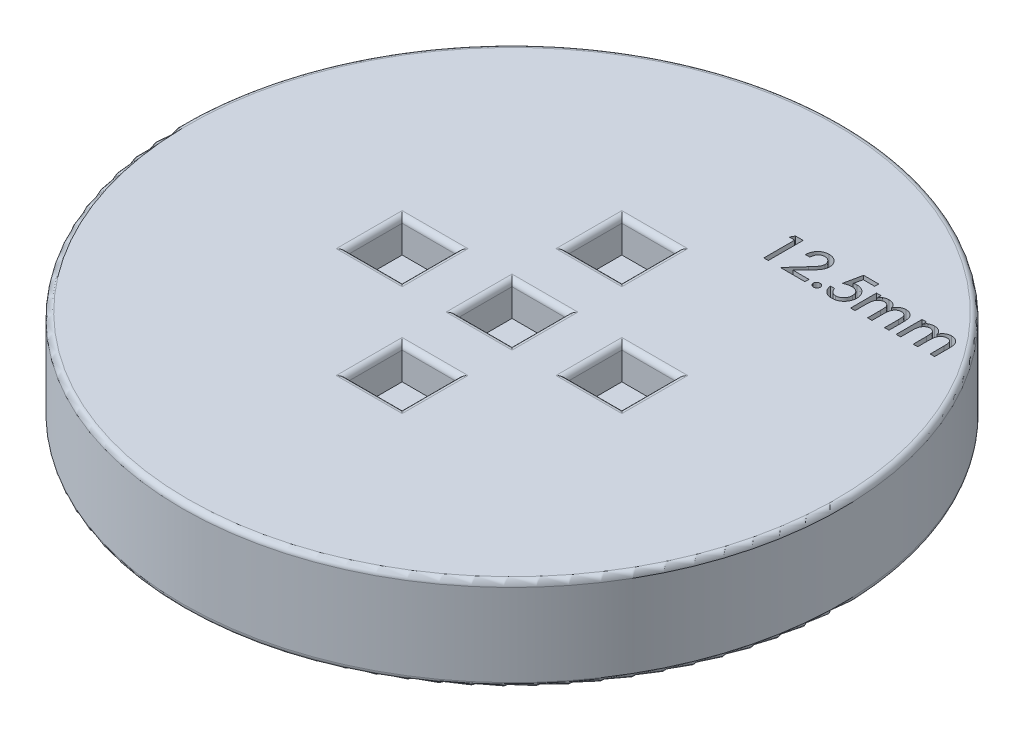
SolidWorks part; units mm, degrees
ref_plane "Front Plane" through (0, 0, 0) normal (0, 0, 1) x (1, 0, 0)
ref_plane "Top Plane" through (0, 0, 0) normal (0, 1, 0) x (1, 0, 0)
ref_plane "Right Plane" through (0, 0, 0) normal (1, 0, 0) x (0, 0, -1)
sketch "Sketch1" plane through (0, 0, 0) normal (0, 1, 0) x (1, 0, 0)
  circle A0 centre (0, 0) radius 30
extrude "Boss-Extrude1" add sketch "Sketch1" along normal blind 8.5
sketch "Sketch2" plane through (0, 8.5, 0) normal (0, 1, 0) x (1, 0, 0)
  line L0 (0, 0) -> (0, -10) construction
  line L1 (0, 0) -> (10, 0) construction
  line L2 (0, 0) -> (-10, 0) construction
  line L3 (0, 0) -> (0, 10) construction
  line L5 (-2.5, -7.5) -> (2.5, -7.5)
  line L6 (-2.5, -7.5) -> (-2.5, -12.5)
  line L7 (-2.5, -12.5) -> (2.5, -12.5)
  line L8 (2.5, -7.5) -> (2.5, -12.5)
  line L9 (-2.5, -7.5) -> (2.5, -12.5) construction
  line L10 (-2.5, -12.5) -> (2.5, -7.5) construction
  line L11 (-7.5, -2.5) -> (-12.5, -2.5)
  line L12 (-7.5, -2.5) -> (-7.5, 2.5)
  line L13 (-7.5, 2.5) -> (-12.5, 2.5)
  line L14 (-12.5, -2.5) -> (-12.5, 2.5)
  line L15 (-7.5, -2.5) -> (-12.5, 2.5) construction
  line L16 (-7.5, 2.5) -> (-12.5, -2.5) construction
  line L17 (2.5, -2.5) -> (-2.5, -2.5)
  line L18 (2.5, -2.5) -> (2.5, 2.5)
  line L19 (2.5, 2.5) -> (-2.5, 2.5)
  line L20 (-2.5, -2.5) -> (-2.5, 2.5)
  line L21 (2.5, -2.5) -> (-2.5, 2.5) construction
  line L22 (2.5, 2.5) -> (-2.5, -2.5) construction
  line L23 (-2.5, 12.5) -> (2.5, 12.5)
  line L24 (-2.5, 12.5) -> (-2.5, 7.5)
  line L25 (-2.5, 7.5) -> (2.5, 7.5)
  line L26 (2.5, 12.5) -> (2.5, 7.5)
  line L27 (-2.5, 12.5) -> (2.5, 7.5) construction
  line L28 (-2.5, 7.5) -> (2.5, 12.5) construction
  line L29 (12.5, -2.5) -> (7.5, -2.5)
  line L30 (12.5, -2.5) -> (12.5, 2.5)
  line L31 (12.5, 2.5) -> (7.5, 2.5)
  line L32 (7.5, -2.5) -> (7.5, 2.5)
  line L33 (12.5, -2.5) -> (7.5, 2.5) construction
  line L34 (12.5, 2.5) -> (7.5, -2.5) construction
  dimension "D1" = 5
  dimension "D2" = 10
  dimension "D3" = 5
  dimension "D4" = 5
  dimension "D5" = 5
  dimension "D6" = 5
  dimension "D7" = 5
  dimension "D8" = 5
extrude "Cut-Extrude1" cut sketch "Sketch2" against normal blind 3
fillet "Fillet1" radius 0.5 6 edges at (2.5, 8.5, 0) (0, 8.5, 2.5) (-12.5, 8.5, 0) (-10, 8.5, 2.5) (-7.5, 8.5, 0) (-10, 8.5, -2.5)
sketch "Sketch3" plane through (0, 8.5, 0) normal (0, 1, 0) x (1, 0, 0)
sketch "Sketch4" plane through (0, 0, 0) normal (0, -1, 0) x (-1, 0, 0)
  line L0 (0, 0) -> (-10, 0) construction
  line L1 (0, 0) -> (0, -10) construction
  line L2 (0, 0) -> (0, 10) construction
  line L3 (0, 0) -> (10, 0) construction
  line L5 (-2.5, 2.5) -> (2.5, 2.5)
  line L6 (-2.5, 2.5) -> (-2.5, -2.5)
  line L7 (-2.5, -2.5) -> (2.5, -2.5)
  line L8 (2.5, 2.5) -> (2.5, -2.5)
  line L9 (-2.5, 2.5) -> (2.5, -2.5) construction
  line L10 (-2.5, -2.5) -> (2.5, 2.5) construction
  line L11 (-2.5, -7.5) -> (2.5, -7.5)
  line L12 (-2.5, -7.5) -> (-2.5, -12.5)
  line L13 (-2.5, -12.5) -> (2.5, -12.5)
  line L14 (2.5, -7.5) -> (2.5, -12.5)
  line L15 (-2.5, -7.5) -> (2.5, -12.5) construction
  line L16 (-2.5, -12.5) -> (2.5, -7.5) construction
  line L17 (7.5, 2.5) -> (12.5, 2.5)
  line L18 (7.5, 2.5) -> (7.5, -2.5)
  line L19 (7.5, -2.5) -> (12.5, -2.5)
  line L20 (12.5, 2.5) -> (12.5, -2.5)
  line L21 (7.5, 2.5) -> (12.5, -2.5) construction
  line L22 (7.5, -2.5) -> (12.5, 2.5) construction
  line L23 (-12.5, 2.5) -> (-7.5, 2.5)
  line L24 (-12.5, 2.5) -> (-12.5, -2.5)
  line L25 (-12.5, -2.5) -> (-7.5, -2.5)
  line L26 (-7.5, 2.5) -> (-7.5, -2.5)
  line L27 (-12.5, 2.5) -> (-7.5, -2.5) construction
  line L28 (-12.5, -2.5) -> (-7.5, 2.5) construction
  line L29 (2.5, 7.5) -> (-2.5, 7.5)
  line L30 (2.5, 7.5) -> (2.5, 12.5)
  line L31 (2.5, 12.5) -> (-2.5, 12.5)
  line L32 (-2.5, 7.5) -> (-2.5, 12.5)
  line L33 (2.5, 7.5) -> (-2.5, 12.5) construction
  line L34 (2.5, 12.5) -> (-2.5, 7.5) construction
  dimension "D1" = 5
  dimension "D2" = 5
  dimension "D3" = 5
  dimension "D4" = 5
  dimension "D5" = 5
  dimension "D6" = 5
extrude "Cut-Extrude2" cut sketch "Sketch4" against normal blind 3
fillet "Fillet2" radius 0.5 21 edges at (0, 0, 30) (2.5, 0, 0) (0, 0, 2.5) (-2.5, 0, 0) (0, 0, -2.5) (2.5, 0, 10) (0, 0, 12.5) (-2.5, 0, 10) (0, 0, 7.5) (-7.5, 0, 0) (-10, 0, 2.5) (-12.5, 0, 0) (-10, 0, -2.5) (12.5, 0, 0) (10, 0, 2.5) (7.5, 0, 0) (10, 0, -2.5) (-2.5, 0, -10) (0, 0, -12.5) (2.5, 0, -10) (0, 0, -7.5)
fillet "Fillet3" radius 0.5 15 edges at (0, 8.5, 30) (0, 8.5, 7.5) (-2.5, 8.5, 10) (0, 8.5, 12.5) (2.5, 8.5, 10) (-2.5, 8.5, 0.25) (0.25, 8.5, -2.5) (0, 8.5, -12.5) (-2.5, 8.5, -10) (0, 8.5, -7.5) (2.5, 8.5, -10) (10, 8.5, 2.5) (12.5, 8.5, 0) (10, 8.5, -2.5) (7.5, 8.5, 0)
sketch "Sketch5" plane through (0, 8.5, 0) normal (0, 1, 0) x (1, 0, 0)
  text T0 "<b>12.5mm</b>"
extrude "Cut-Extrude3" cut sketch "Sketch5" against normal blind 2
